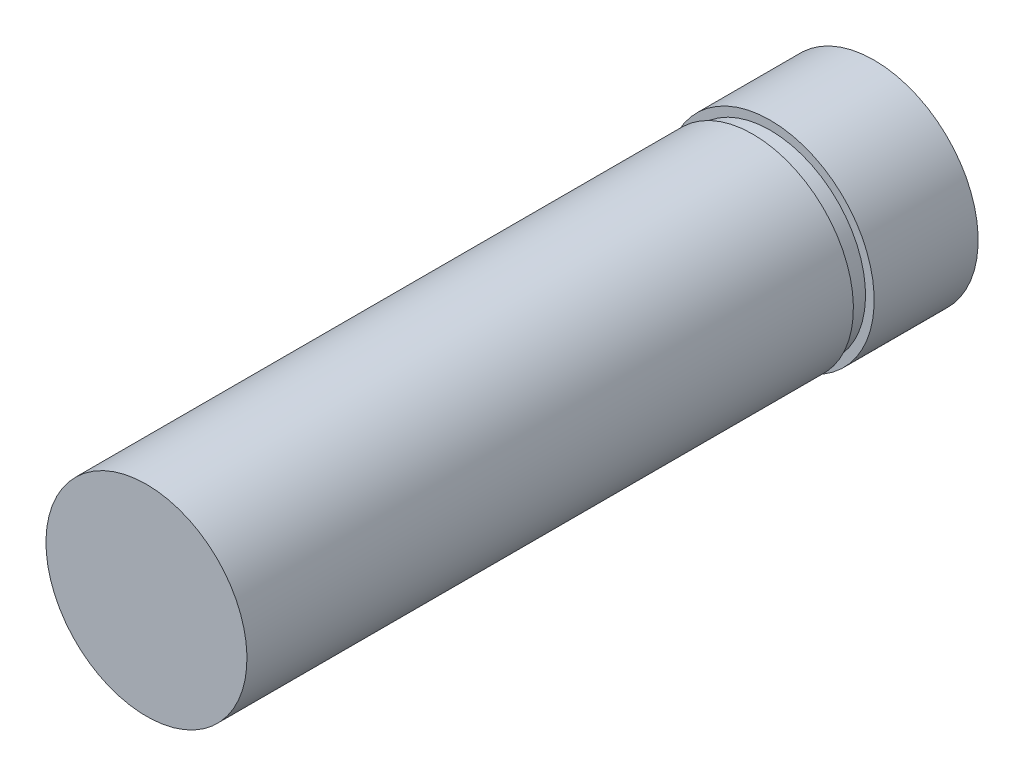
SolidWorks part; units mm, degrees
ref_plane "Front Plane" through (0, 0, 0) normal (0, 0, 1) x (1, 0, 0)
ref_plane "Top Plane" through (0, 0, 0) normal (0, 1, 0) x (1, 0, 0)
ref_plane "Right Plane" through (0, 0, 0) normal (1, 0, 0) x (0, 0, -1)
ref_plane "Plane1" through (0, 0, 0) normal (0, -1, 0) x (1, 0, 0)
sketch "Sketch1" plane through (0, 0, 0) normal (0, -1, 0) x (1, 0, 0)
  line L0 (2.75, 0.1) -> (2.9, 0.1)
  line L1 (0, 17.6) -> (0, -3.4)
  line L2 (0, -3.4) -> (3, -3.4)
  line L3 (3, -3.4) -> (3, -0.4)
  line L4 (3, -0.4) -> (2.75, -0.4)
  line L5 (2.9, 0.1) -> (2.9, 17.6)
  line L6 (2.75, -0.4) -> (2.75, 0.1)
  line L7 (2.9, 17.6) -> (0, 17.6)
  line L8 (0, 17.6) -> (0, -3.4) construction
  dimension "D1" = 3
  dimension "D2" = 2.75
  dimension "D3" = 2.9
  dimension "D4" = 3.4
  dimension "D6" = 3
  dimension "D7" = 3.5
  dimension "D8" = 21
revolve "Revolve1" add sketch "Sketch1" angle 360 about L8
